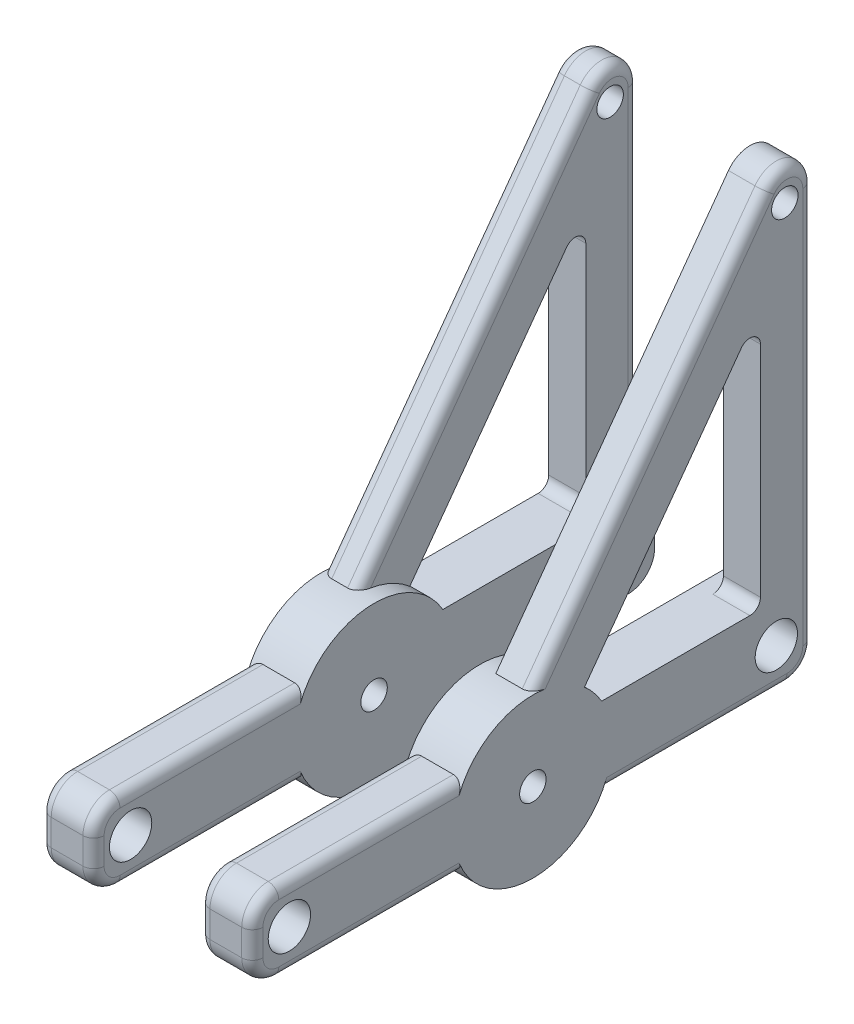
SolidWorks part; units mm, degrees
ref_plane "Front Plane" through (0, 0, 0) normal (0, 0, 1) x (1, 0, 0)
ref_plane "Top Plane" through (0, 0, 0) normal (0, 1, 0) x (1, 0, 0)
ref_plane "Right Plane" through (0, 0, 0) normal (1, 0, 0) x (0, 0, -1)
sketch "Sketch1" plane through (0, 0, 0) normal (1, 0, 0) x (0, 0, -1)
  circle A0 centre (0, 0) radius 19.05
  circle A1 centre (0, 0) radius 3.175
  dimension "D1" = 38.1
  dimension "D2" = 6.35
extrude "Boss-Extrude1" add sketch "Sketch1" along normal blind 12.7
ref_plane "Plane1" through (0, 0, 16.51) normal (0, 0, 1) x (1, 0, 0)
sketch "Sketch2" plane through (0, 0, 16.51) normal (0, 0, 1) x (1, 0, 0)
  line L2 (0, 19.05) -> (0, -19.05) construction
  line L3 (0, 9.5082) -> (0, -9.5418)
  line L5 (0, -9.5418) -> (12.7, -9.5418)
  line L6 (12.7, -9.5418) -> (12.7, 9.5082)
  line L7 (0, 9.5082) -> (12.7, 9.5082)
  dimension "D1" = 9.5082
  dimension "D2" = 19.05
  dimension "D3" = 12.7
extrude "Boss-Extrude3" add sketch "Sketch2" along normal blind 50.8
ref_plane "Plane2" through (0, 0, -16.51) normal (0, 0, 1) x (1, 0, 0)
sketch "Sketch3" plane through (0, 0, -16.51) normal (0, 0, 1) x (1, 0, 0)
  line L0 (0, 9.5082) -> (12.7, 9.5082)
  line L1 (12.7, 9.5082) -> (12.7, -9.5038)
  line L2 (12.7, -9.5038) -> (0, -9.5038)
  line L3 (0, -9.5038) -> (0, 9.5082)
  dimension "D2" = 12.7
extrude "Boss-Extrude4" add sketch "Sketch3" against normal blind 50.8
ref_plane "Plane3" through (25.4, 0, 0) normal (1, 0, 0) x (0, 0, -1)
sketch "Sketch7" plane through (0, 0, 0) normal (-1, 0, 0) x (0, 0, 1)
  line L0 (67.31, 9.5082) -> (67.31, -9.5418) construction
  line L1 (67.31, 9.5082) -> (16.51, 9.5082) construction
  line L2 (-67.31, 9.5082) -> (-67.31, -9.5038) construction
  line L3 (-67.31, 9.5082) -> (-16.51, 9.5082) construction
  circle A0 centre (58.42, 0.1102) radius 5.08
  circle A1 centre (-58.42, 0.1102) radius 5.08
  dimension "D3" = 10.16
  dimension "D4" = 10.16
  dimension "D1" = 8.89
  dimension "D2" = 9.398
  dimension "D5" = 8.89
  dimension "D6" = 9.398
sketch "Sketch8" plane through (0, 0, 0) normal (1, 0, 0) x (0, 0, -1)
  line L0 (67.31, 9.5082) -> (67.31, 111.4289)
  line L2 (67.31, 111.4289) -> (0, 19.05)
  line L3 (12.3819, 14.4773) -> (54.61, 72.4328)
  line L4 (54.61, 72.4328) -> (54.61, 9.5082)
  line L5 (67.31, 9.5082) -> (16.51, 9.5082) construction
  line L6 (54.61, 9.5082) -> (67.31, 9.5082)
  arc A0 (16.51, 9.5038) -> (-16.51, 9.5038) centre (0, 0) ccw construction
  spline S0 degree 3 poles (0, 19.05) (3.5191, 18.8154) (9.4184, 16.0664) (12.3819, 14.4773) knots 0 0 0 0 1 1 1 1
  point P1 (67.31, 110.2252)
  point P13 (67.31, 77.433)
  dimension "D1" = 12.7
  dimension "D2" = 12.7
  dimension "D3" = 114.3
extrude "Boss-Extrude7" add sketch "Sketch8" along normal blind 8.89
mirror "Mirror3" about plane through (25.4, 0, 0) normal (1, 0, 0)
extrude "Cut-Extrude3" cut sketch "Sketch7" against normal through all
sketch "Sketch9" plane through (0, 0, 0) normal (-1, 0, 0) x (0, 0, 1)
  line L0 (-67.31, 111.4289) -> (-67.31, -9.5038) construction
  circle A0 centre (-60.452, 91.1089) radius 3.175
  dimension "D1" = 6.35
  dimension "D2" = 6.858
  dimension "D3" = 20.32
extrude "Cut-Extrude4" cut sketch "Sketch9" against normal through all
fillet "Fillet2" radius 6.35 4 edges at (6.35, -9.5418, 67.31) (6.35, 9.5082, 67.31) (6.35, -9.5038, -67.31) (4.445, 111.4289, -67.31)
fillet "Fillet3" radius 6.35 4 edges at (44.45, 9.5082, 67.31) (44.45, -9.5418, 67.31) (44.45, -9.5038, -67.31) (46.355, 111.4289, -67.31)
fillet "Fillet4" radius 2.54 18 edges at (12.7, -9.5418, 38.735) (12.7, -7.6819, 65.4501) (12.7, -0.0168, 67.31) (12.7, 7.6483, 65.4501) (0, -9.5418, 38.735) (0, -7.6819, 65.4501) (0, -0.0168, 67.31) (0, 7.6483, 65.4501) (8.89, 50.7195, -67.31) (8.89, 97.9687, -62.9264) (0, -9.5038, -38.735) (0, -7.6439, -65.4501) (0, 44.3885, -67.31) (0, 97.9687, -62.9264) (12.7, 9.5082, 38.735) (0, 9.5082, 38.735) (8.89, 57.3601, -27.9139) (0, 57.3601, -27.9139)
fillet "Fillet5" radius 2.54 2 edges at (4.445, 72.4328, -54.61) (4.445, 9.5082, -54.61)
fillet "Fillet6" radius 2.54 17 edges at (50.8, -9.5418, 38.735) (50.8, -7.6819, 65.4501) (50.8, -0.0168, 67.31) (50.8, 7.6483, 65.4501) (38.1, -9.5418, 38.735) (38.1, -7.6819, 65.4501) (38.1, -0.0168, 67.31) (38.1, 7.6483, 65.4501) (50.8, -9.5038, -38.735) (50.8, -7.6439, -65.4501) (50.8, 44.3885, -67.31) (50.8, 97.9687, -62.9264) (50.8, 9.5082, 38.735) (38.1, 9.5082, 38.735) (46.355, 72.4328, -54.61) (46.355, 9.5082, -54.61) (50.8, 57.3601, -27.9139)
